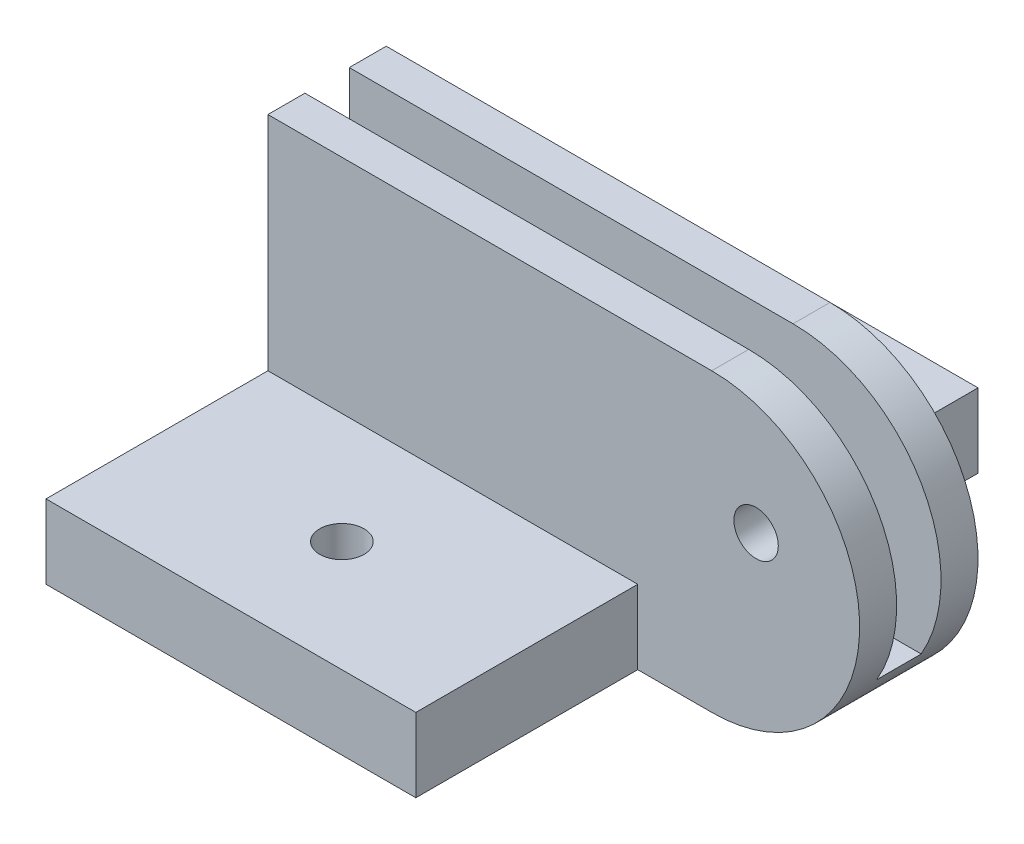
SolidWorks part; units mm, degrees
ref_plane "Alzado" through (0, 0, 0) normal (0, 0, 1) x (1, 0, 0)
ref_plane "Planta" through (0, 0, 0) normal (0, 1, 0) x (1, 0, 0)
ref_plane "Vista lateral" through (0, 0, 0) normal (1, 0, 0) x (0, 0, -1)
sketch "Croquis1" plane through (0, 0, 0) normal (0, 0, 1) x (1, 0, 0)
  line L5 (-30, 10) -> (0, 10)
  line L6 (-30, 10) -> (-30, -10)
  line L7 (-30, -10) -> (0, -10)
  arc A0 (0, -10) -> (0, 10) centre (0, 0) ccw
  dimension "D1" = 20
  dimension "D2" = 30
  dimension "20" = 20
extrude "Saliente-Extruir1" add sketch "Croquis1" along normal blind 8
sketch "Croquis2" plane through (0, -10, 0) normal (0, -1, 0) x (1, 0, 0)
  line L0 (-5, 0) -> (-5, -15)
  line L1 (-30, 23) -> (-5, 23)
  line L2 (-30, 23) -> (-30, 8)
  line L3 (-30, -15) -> (-5, -15)
  line L6 (-5, 8) -> (-30, 8)
  line L7 (0, 8) -> (0, 0) construction
  line L8 (0, 8) -> (0, 0) construction
  line L10 (-30, 0) -> (-5, 0)
  line L12 (-30, 0) -> (-30, -15)
  line L14 (-5, 23) -> (-5, 8)
  dimension "D1" = 5
  dimension "D2" = 15
  dimension "D3" = 15
  dimension "D4" = 8
extrude "Saliente-Extruir2" add sketch "Croquis2" against normal blind 5
sketch "Croquis5" plane through (0, 10, 0) normal (0, 1, 0) x (1, 0, 0)
  line L0 (10, -5.5) -> (-30, -5.5)
  line L2 (10, -2.5) -> (-30, -2.5)
  line L3 (-30, -5.5) -> (-30, -2.5)
  line L5 (10, -5.5) -> (10, -2.5)
  line L6 (10, -8) -> (10, 0) construction
  line L7 (-30, -8) -> (-30, 0) construction
  line L8 (10, -2.5) -> (-30, -2.5) construction
  point P2 (-30, -4)
  point P3 (10, -4)
  point P6 (-10, -2.5)
  dimension "D2" = 3
extrude "Cortar-Extruir5" cut sketch "Croquis5" against normal blind 15
sketch "Croquis8" plane through (0, 0, 8) normal (0, 0, 1) x (1, 0, 0)
  circle A0 centre (3, 2) radius 1.5
  arc A1 (0, -10) -> (0, 10) centre (0, 0) ccw construction
  dimension "D1" = 3
  dimension "D2" = 7
  dimension "D3" = 3
extrude "Cortar-Extruir6" cut sketch "Croquis8" against normal through all
sketch "Croquis9" plane through (0, -5, 0) normal (0, 1, 0) x (1, 0, 0)
  line L0 (-17.5, 0) -> (-17.5, 15) construction
  line L1 (-5, 0) -> (-30, 0) construction
  line L2 (-30, 15) -> (-5, 15) construction
  line L3 (-5, -23) -> (-30, -23) construction
  line L4 (-17.5, -8) -> (-17.5, -23) construction
  line L5 (-30, -8) -> (-5, -8) construction
  circle A0 centre (-17.5, 7.5) radius 1.5
  circle A1 centre (-17.5, -15.5) radius 1.5
  point P16 (-17.5, 7.5)
  point P17 (-17.5, -15.5)
  dimension "D1" = 3
  dimension "D2" = 3
extrude "Cortar-Extruir7" cut sketch "Croquis9" against normal through all
